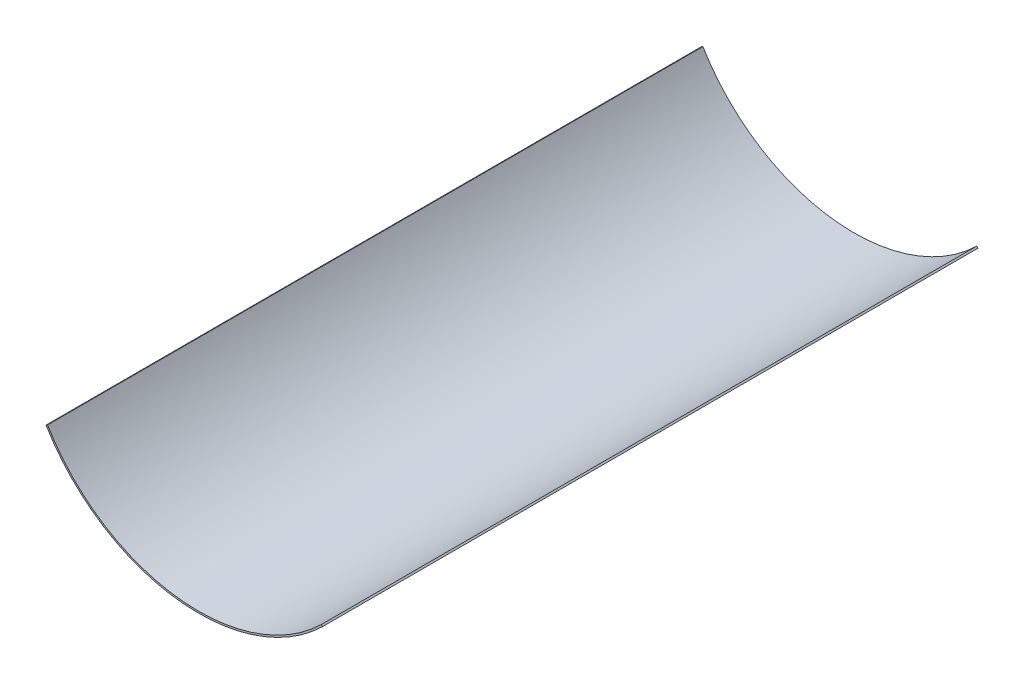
SolidWorks part; units mm, degrees
ref_plane "Plan de face" through (0, 0, 0) normal (0, 0, 1) x (1, 0, 0)
ref_plane "Plan de dessus" through (0, 0, 0) normal (0, 1, 0) x (1, 0, 0)
ref_plane "Plan de droite" through (0, 0, 0) normal (1, 0, 0) x (0, 0, -1)
sketch "Esquisse1" plane through (0, 0, 0) normal (0, 0, 1) x (1, 0, 0)
  line L0 (140.9732, -144.6739) -> (139.5775, -143.2415)
  line L1 (-171.7567, -102.4678) -> (-173.4742, -103.4924)
  arc A0 (-173.4742, -103.4924) -> (140.9732, -144.6739) centre (0, 0) ccw
  arc A1 (-171.7567, -102.4678) -> (139.5775, -143.2415) centre (0, 0) ccw
  dimension "D1" = 404
  dimension "D2" = 400
extrude "Boss.-Extru.1" add sketch "Esquisse1" along normal blind 745
